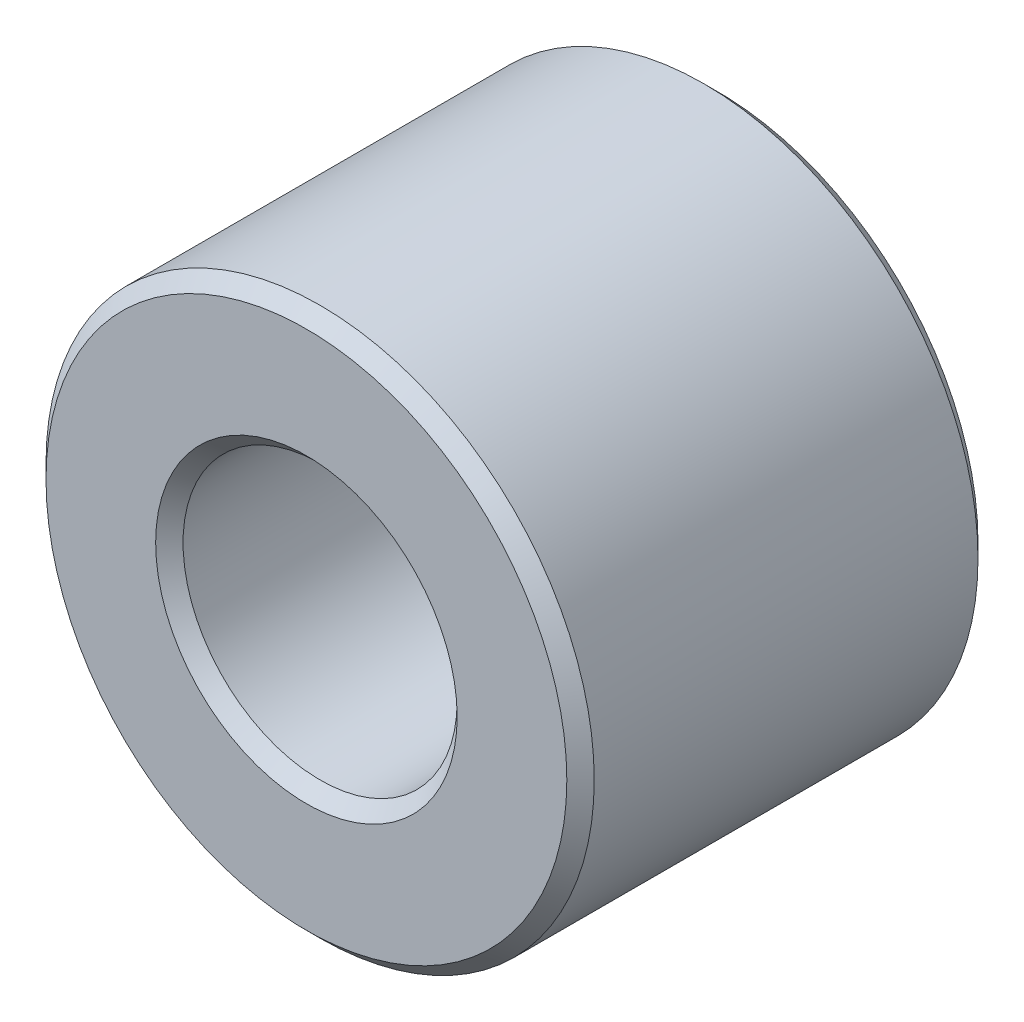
SolidWorks part; units mm, degrees
ref_plane "Front Plane" through (0, 0, 0) normal (0, 0, 1) x (1, 0, 0)
ref_plane "Top Plane" through (0, 0, 0) normal (0, 1, 0) x (1, 0, 0)
ref_plane "Right Plane" through (0, 0, 0) normal (1, 0, 0) x (0, 0, -1)
sketch "Sketch1" plane through (0, 0, 0) normal (0, 0, 1) x (1, 0, 0)
  circle A0 centre (0, 0) radius 20
  circle A1 centre (0, 0) radius 40
  dimension "D1" = 40
  dimension "D2" = 80
extrude "Boss-Extrude1" add sketch "Sketch1" along normal mid plane 60
chamfer "Chamfer1" distance 2 angle 45 4 edges at (20, 0, -30) (40, 0, -30) (20, 0, 30) (40, 0, 30)
